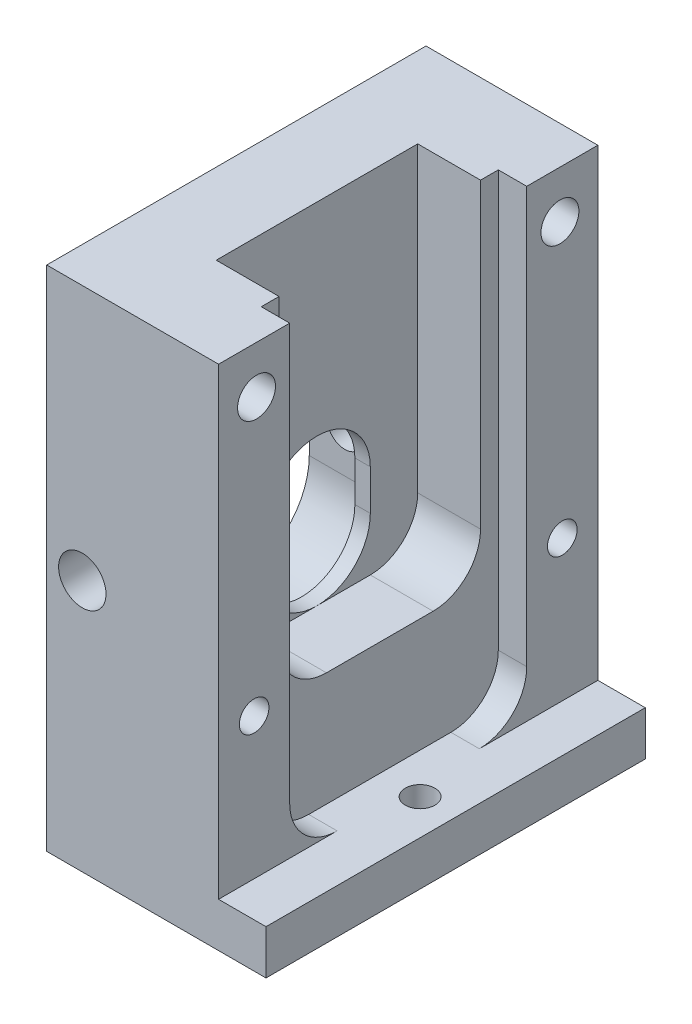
SolidWorks part; units mm, degrees
ref_plane "FACE" through (0, 0, 0) normal (0, 0, 1) x (1, 0, 0)
ref_plane "DESSUS" through (0, 0, 0) normal (0, 1, 0) x (1, 0, 0)
ref_plane "GAUCHE" through (0, 0, 0) normal (1, 0, 0) x (0, 0, -1)
sketch "Esquisse1" plane through (0, 0, 0) normal (0, 0, 1) x (1, 0, 0)
  line L0 (0, 0) -> (0, 42.85)
  line L1 (0, 42.85) -> (14.5, 42.85)
  line L2 (14.5, 42.85) -> (14.5, 3.75)
  line L3 (14.5, 3.75) -> (18.5, 3.75)
  line L4 (18.5, 3.75) -> (18.5, 0)
  line L5 (18.5, 0) -> (0, 0)
  dimension "EpSup" = 14.5
  dimension "HtSup" = 42.85
  dimension "EqSup" = 39.1
  dimension "LgSup" = 18.5
extrude "Base-en-L" add sketch "Esquisse1" along normal blind 32
sketch "Esquisse2" plane through (14.5, 0, 0) normal (1, 0, 0) x (0, 0, -1)
  line L1 (-24.5, 42.85) -> (-7.5, 42.85)
  line L2 (-24.5, 42.85) -> (-24.5, 13.35)
  line L3 (-24.5, 13.35) -> (-7.5, 13.35)
  line L4 (-7.5, 42.85) -> (-7.5, 13.35)
  line L5 (-32, 42.85) -> (0, 42.85) construction
  line L6 (0, 3.75) -> (0, 42.85) construction
  dimension "LgRai1" = 17
  dimension "HtRai1" = 29.5
  dimension "PosRai1" = 7.5
extrude "Rainure1" cut sketch "Esquisse2" against normal blind 7.7
fillet "CongéRain1" radius 4
sketch "Esquisse3" plane through (14.5, 0, 0) normal (1, 0, 0) x (0, 0, -1)
  line L0 (-7.5, 42.85) -> (0, 42.85) construction
  line L1 (-7.5, 17.35) -> (-7.5, 42.85) construction
  line L2 (-20.5, 13.35) -> (-11.5, 13.35) construction
  line L3 (-24.5, 42.85) -> (-24.5, 17.35) construction
  line L4 (-32, 42.85) -> (-24.5, 42.85) construction
  line L5 (-7.5, 42.85) -> (-6, 42.85)
  line L6 (-7.5, 17.35) -> (-7.5, 42.85)
  line L7 (-20.5, 13.35) -> (-11.5, 13.35)
  line L8 (-24.5, 42.85) -> (-24.5, 17.35)
  line L9 (-26, 42.85) -> (-24.5, 42.85)
  line L10 (-32, 3.75) -> (0, 3.75) construction
  line L11 (-26, 3.75) -> (-6, 3.75)
  line L12 (-26, 42.85) -> (-26, 3.75)
  line L13 (-6, 42.85) -> (-6, 3.75)
  arc A0 (-11.5, 13.35) -> (-7.5, 17.35) centre (-11.5, 17.35) ccw construction
  arc A1 (-24.5, 17.35) -> (-20.5, 13.35) centre (-20.5, 17.35) ccw construction
  arc A2 (-11.5, 13.35) -> (-7.5, 17.35) centre (-11.5, 17.35) ccw
  arc A3 (-24.5, 17.35) -> (-20.5, 13.35) centre (-20.5, 17.35) ccw
  dimension "PosRai2" = 1.5
  dimension "LgRai2" = 20
extrude "Rainure2" cut sketch "Esquisse3" against normal blind 2.4
fillet "CongéRain2" radius 4
sketch "Esquisse4" plane through (6.8, 0, 0) normal (1, 0, 0) x (0, 0, -1)
  line L0 (-11.5, 13.35) -> (-20.5, 13.35) construction
  line L1 (-7.5, 42.85) -> (-7.5, 17.35) construction
  line L2 (-20.5, 17.85) -> (-20.5, 21.25)
  line L3 (-11.5, 17.85) -> (-11.5, 21.25)
  line L4 (-7.5, 17.35) -> (-7.5, 42.85) construction
  arc A0 (-20.5, 17.85) -> (-11.5, 17.85) centre (-16, 17.85) ccw
  arc A1 (-11.5, 21.25) -> (-20.5, 21.25) centre (-16, 21.25) ccw
  dimension "D1" = 3.4
  dimension "RayOblg1" = 9
  dimension "PosOblg1" = 8.5
extrude "Oblong1" cut sketch "Esquisse4" against normal through all
sketch "Esquisse5" plane through (0, 0, 0) normal (-1, 0, 0) x (0, 0, 1)
  line L1 (22.15, 21.25) -> (22.15, 17.85)
  line L2 (9.85, 21.25) -> (9.85, 17.85)
  arc A0 (9.85, 17.85) -> (22.15, 17.85) centre (16, 17.85) ccw
  arc A1 (11.5, 17.85) -> (20.5, 17.85) centre (16, 17.85) ccw construction
  arc A2 (22.15, 21.25) -> (9.85, 21.25) centre (16, 21.25) ccw
  arc A3 (20.5, 21.25) -> (11.5, 21.25) centre (16, 21.25) ccw construction
  dimension "DiaOblg2" = 12.3
extrude "Oblong2" cut sketch "Esquisse5" against normal blind 5.5
sketch "Esquisse6" plane through (0, 0, 32) normal (0, 0, 1) x (1, 0, 0)
  line L1 (0, 0) -> (18.5, 0) construction
  line L2 (0, 42.85) -> (0, 0) construction
  circle A0 centre (3, 21.3) radius 1.5
  dimension "D1" = 3
  dimension "Percage1" = 3
  dimension "Pos2Perc1" = 21.3
extrude "Percage1" cut sketch "Esquisse6" against normal through all
sketch "Esquisse7" plane through (0, 0, 32) normal (0, 0, 1) x (1, 0, 0)
  circle A0 centre (3, 21.3) radius 2
  circle A1 centre (3, 21.3) radius 1.5 construction
  dimension "Lam1Perc1" = 4
extrude "Lamage1" cut sketch "Esquisse7" against normal blind 3.75
ref_plane "Plan1" through (0, 0, 16) normal (0, 0, 1) x (1, 0, 0)
mirror "Symétrie1" about plane through (0, 0, 16) normal (0, 0, 1)
hole_wizard "Taraudage1" positions "Esquisse11" profile "Esquisse10" tap size "M3x0.5" standard "ISO"
sketch "Esquisse11" plane through (0, 0, 0) normal (0, -1, 0) x (1, 0, 0)
  line L0 (18.5, 32) -> (18.5, 0) construction
  line L1 (50, 16) -> (-50, 16) construction
  point P0 (15.5, 16)
  dimension "D1" = 3
sketch "Esquisse10" plane through (15.5, 0, 16) normal (1, 0, 0) x (0, 0, -1)
  line L0 (0, 0) -> (0, 42.85)
  line L1 (0, 42.85) -> (1.25, 42.85)
  line L2 (1.25, 42.85) -> (1.25, 0)
  line L5 (1.25, 0) -> (0, 0)
  line L11 (0, -6.35) -> (0, 107.95) construction
  dimension "Diamètre du perçage jusqu'au prochain" = 2.5
  dimension "Profondeur du perçage jusqu'au prochain" = 42.85
hole_wizard "Taraudage2" positions "Esquisse13" profile "Esquisse12" tap size "M3x0.5" standard "ISO"
sketch "Esquisse13" plane through (14.5, 0, 0) normal (1, 0, 0) x (0, 0, -1)
  line L0 (0, 3.75) -> (0, 42.85) construction
  line L1 (-32, 0) -> (0, 0) construction
  point P0 (-3, 15.65)
  dimension "D1" = 3
  dimension "D2" = 15.65
sketch "Esquisse12" plane through (14.5, 15.65, 3) normal (0, 1, 0) x (0, 0, -1)
  line L0 (0, 0) -> (0, 9.2217)
  line L1 (0, 9.2217) -> (1.25, 8.5)
  line L2 (1.25, 8.5) -> (1.25, 0)
  line L5 (1.25, 0) -> (0, 0)
  line L10 (0, 9.2217) -> (-1.25, 8.5) construction
  line L11 (0, -6.35) -> (0, 107.95) construction
  dimension "Diamètre du perçage" = 2.5
  dimension "Profondeur du perçage" = 8.5
  dimension "Angle de pointe" = 120
mirror "Symétrie2" about plane through (0, 0, 16) normal (0, 0, 1)
ref_plane "Plan2" through (0, 38.85, 0) normal (0, -1, 0) x (1, 0, 0)
sketch "Esquisse14" plane through (0, 38.85, 0) normal (0, -1, 0) x (1, 0, 0)
  line L0 (17.5269, 28.8) -> (-3.1269, 28.8) construction
  line L1 (14.5, 32) -> (0, 32) construction
  line L2 (14.5, 27.2) -> (3.5, 27.2)
  line L3 (3.5, 27.2) -> (2, 25.7)
  line L4 (2, 25.7) -> (0, 25.7)
  line L5 (0, 32) -> (0, 0) construction
  line L6 (14.5, 32) -> (14.5, 26) construction
  line L7 (0, 28.8) -> (0, 25.7)
  line L8 (14.5, 28.8) -> (14.5, 27.2)
  line L9 (14.5, 28.8) -> (0, 28.8)
  dimension "PosTroulamé" = 3.2
  dimension "DiaTrou" = 1.6
  dimension "DIALam" = 3.1
  dimension "ChanfLam" = 45
  dimension "LngTrou" = 11
revolve "TrouLamé" cut sketch "Esquisse14" angle 360 about L0
mirror "Symétrie3" about plane through (0, 0, 16) normal (0, 0, 1)
